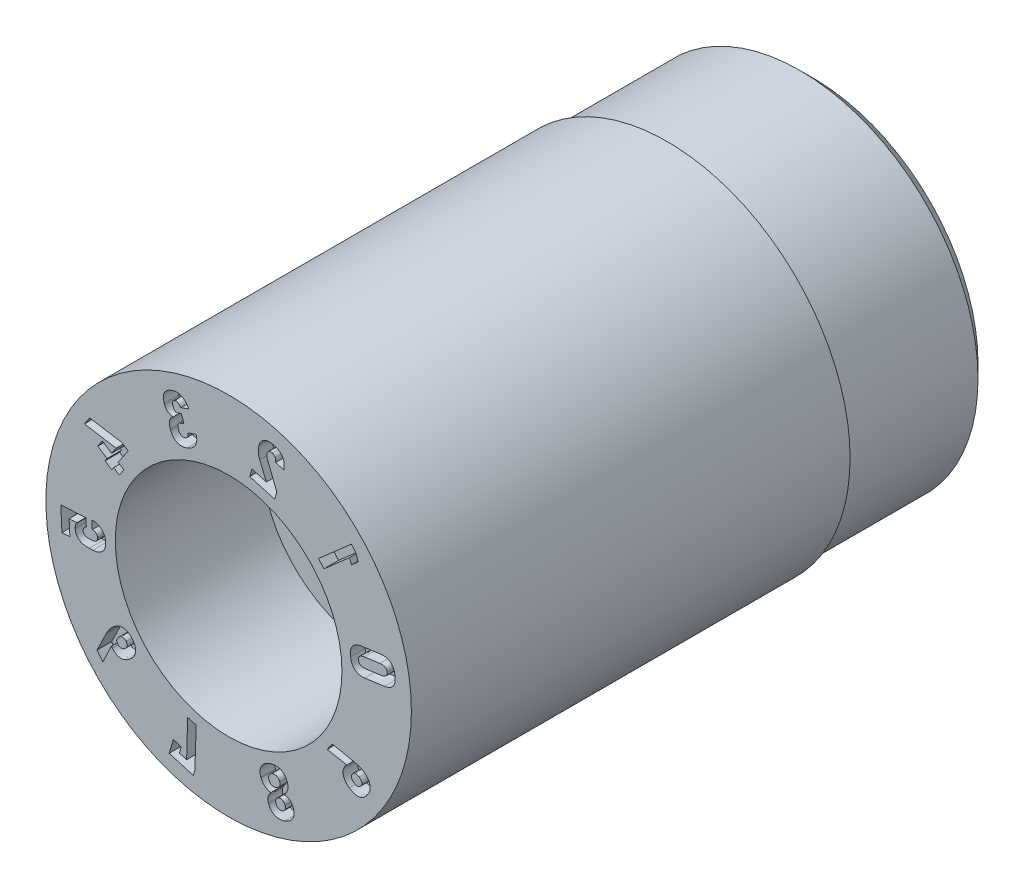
SolidWorks part; units mm, degrees
ref_plane "Front Plane" through (0, 0, 0) normal (0, 0, 1) x (1, 0, 0)
ref_plane "Top Plane" through (0, 0, 0) normal (0, 1, 0) x (1, 0, 0)
ref_plane "Right Plane" through (0, 0, 0) normal (1, 0, 0) x (0, 0, -1)
sketch "Sketch1" plane through (0, 0, 0) normal (1, 0, 0) x (0, 0, -1)
  line L2 (0, 2.5) -> (0, 1.55)
  line L3 (7.75, 2.5) -> (0, 2.5)
  line L4 (-3.7979, 0) -> (49996.2021, 0) construction
  line L8 (8, 0.8) -> (2, 0.8)
  line L9 (2, 1.55) -> (2, 0.8)
  line L10 (2, 1.55) -> (0, 1.55)
  line L12 (8, 0.8) -> (8, 2.25)
  line L16 (8, 2.25) -> (7.75, 2.5)
  dimension "D1" = 8
  dimension "D2" = 45
  dimension "D3" = 0.25
  dimension "D4" = 5
  dimension "D5" = 3.1
  dimension "D6" = 2
  dimension "D7" = 1.6
revolve "Revolve1" add sketch "Sketch1" angle 360 about L4
sketch "Sketch4" plane through (0, 0, 0) normal (1, 0, 0) x (0, 0, -1)
  line L0 (0, 0) -> (50000, 0) construction
  line L1 (8, -2.25) -> (8, 2.25) construction
  line L2 (6, 3.435) -> (8, 3.435)
  line L3 (6, 3.435) -> (6, 2.435)
  line L4 (6, 2.435) -> (8, 2.435)
  line L5 (8, 3.435) -> (8, 2.435)
  line L6 (7.75, 2.5) -> (0, 2.5) construction
  line L7 (0, 2.5) -> (0, -2.5) construction
  dimension "D1" = 1
  dimension "D2" = 0.065
  dimension "D3" = 6
revolve "Cut-Revolve1" cut sketch "Sketch4" angle 360 about L0
sketch "Sketch6" plane through (0, 0, 0) normal (0, 0, 1) x (1, 0, 0)
  line L0 (1.8611, 0.0756) -> (2.1314, 0.113)
  line L1 (2.0824, 0.4687) -> (1.8121, 0.4313)
  line L2 (1.8562, 0.3233) -> (2.0692, 0.3527)
  line L3 (2.0873, 0.221) -> (1.8743, 0.1916)
  line L4 (1.2295, 1.1761) -> (1.3039, 1.0913)
  line L5 (1.3039, 1.0913) -> (1.6538, 1.3984)
  line L6 (1.6538, 1.3984) -> (1.6812, 1.3256)
  line L7 (1.6812, 1.3256) -> (1.771, 1.4045)
  line L8 (1.771, 1.4045) -> (1.7425, 1.4982)
  line L9 (1.7425, 1.4982) -> (1.6789, 1.5706)
  line L10 (1.6789, 1.5706) -> (1.2295, 1.1761)
  line L11 (0.6585, 1.6775) -> (0.5342, 1.9946)
  line L12 (0.5259, 2.0729) -> (0.5261, 2.0738)
  line L13 (0.6427, 2.02) -> (0.6426, 2.0196)
  line L14 (0.6426, 2.0196) -> (0.7543, 1.988)
  line L15 (0.7543, 1.988) -> (0.7544, 1.9884)
  line L16 (0.4149, 2.1088) -> (0.4148, 2.1083)
  line L17 (0.4249, 1.9452) -> (0.5161, 1.7253)
  line L18 (0.5161, 1.7253) -> (0.3185, 1.7812)
  line L19 (0.3185, 1.7812) -> (0.2888, 1.6763)
  line L20 (0.2888, 1.6763) -> (0.6307, 1.5793)
  line L21 (0.6307, 1.5793) -> (0.6585, 1.6775)
  line L22 (-0.4447, 1.8099) -> (-0.555, 1.7704)
  line L23 (-0.6817, 1.736) -> (-0.6865, 1.7493)
  line L24 (-0.6589, 1.8352) -> (-0.6108, 1.8525)
  line L25 (-0.6108, 1.8525) -> (-0.6477, 1.9555)
  line L26 (-0.6477, 1.9555) -> (-0.6958, 1.9382)
  line L27 (-0.7592, 1.9815) -> (-0.7626, 1.9912)
  line L28 (-0.6548, 2.0206) -> (-0.5448, 2.06)
  line L29 (-0.8813, 1.9612) -> (-0.875, 1.944)
  line L30 (-0.7982, 1.7) -> (-0.7921, 1.6827)
  line L31 (-1.462, 1.2061) -> (-1.9012, 1.2762)
  line L32 (-1.9012, 1.2762) -> (-1.9724, 1.1697)
  line L33 (-1.9724, 1.1697) -> (-1.54, 1.098)
  line L34 (-1.54, 1.098) -> (-1.6008, 1.0069)
  line L35 (-1.6898, 0.8734) -> (-1.5989, 0.8128)
  line L36 (-1.5989, 0.8128) -> (-1.5728, 0.852)
  line L37 (-1.3753, 1.1483) -> (-1.462, 1.2061)
  line L38 (-1.7273, 1.0913) -> (-1.7902, 0.997)
  line L39 (-1.7902, 0.997) -> (-1.6636, 0.9126)
  line L40 (-1.4957, 0.8006) -> (-1.4329, 0.8949)
  line L41 (-1.4329, 0.8949) -> (-1.5099, 0.9463)
  line L42 (-1.8701, 0.0844) -> (-1.8705, 0.0845)
  line L43 (-1.8705, 0.0845) -> (-1.865, -0.0286)
  line L44 (-1.865, -0.0286) -> (-1.8646, -0.0287)
  line L45 (-1.8629, -0.1556) -> (-1.9132, -0.1581)
  line L46 (-1.946, -0.0385) -> (-1.9512, 0.0672)
  line L47 (-1.9512, 0.0672) -> (-2.2961, 0.0501)
  line L48 (-2.2961, 0.0501) -> (-2.2802, -0.2722)
  line L49 (-2.2802, -0.2722) -> (-2.1713, -0.2667)
  line L50 (-2.1713, -0.2667) -> (-2.1816, -0.0575)
  line L51 (-2.1816, -0.0575) -> (-2.0756, -0.0523)
  line L52 (-1.9076, -0.2711) -> (-1.8573, -0.2686)
  line L53 (-1.5689, -1.0288) -> (-1.5693, -1.0291)
  line L54 (-1.6739, -1.166) -> (-1.8006, -1.4237)
  line L55 (-1.8006, -1.4237) -> (-1.7205, -1.5243)
  line L56 (-1.7205, -1.5243) -> (-1.6018, -1.2772)
  line L58 (-1.3507, -1.3063) -> (-1.3505, -1.3061)
  line L59 (-1.4157, -1.2127) -> (-1.4162, -1.213)
  line L60 (-1.4941, -1.1144) -> (-1.494, -1.1142)
  line L61 (-0.462, -2.1775) -> (-0.4428, -1.6341)
  line L62 (-0.4428, -1.6341) -> (-0.5608, -1.5995)
  line L63 (-0.5608, -1.5995) -> (-0.5742, -2.1091)
  line L64 (-0.5742, -2.1091) -> (-0.6736, -2.0799)
  line L65 (-0.6736, -2.0799) -> (-0.648, -1.9929)
  line L66 (-0.648, -1.9929) -> (-0.7568, -1.9609)
  line L67 (-0.7568, -1.9609) -> (-0.8132, -2.1528)
  line L68 (-0.8132, -2.1528) -> (-0.4832, -2.2499)
  line L69 (-0.4832, -2.2499) -> (-0.462, -2.1775)
  line L70 (0.4402, -1.8068) -> (0.4435, -1.8161)
  line L71 (0.5433, -2.0598) -> (0.5486, -2.0746)
  line L72 (0.8844, -1.9551) -> (0.8791, -1.9403)
  line L73 (0.8026, -1.6884) -> (0.7993, -1.6791)
  line L74 (0.698, -1.7325) -> (0.7, -1.738)
  line L75 (0.5542, -1.7895) -> (0.5521, -1.7836)
  line L76 (0.7707, -1.974) -> (0.7726, -1.9794)
  line L77 (0.6503, -2.0226) -> (0.6482, -2.0167)
  line L79 (1.6509, -1.3297) -> (1.6513, -1.33)
  line L80 (1.846, -1.0392) -> (1.8457, -1.039)
  line L81 (1.6878, -0.9826) -> (1.4157, -0.9273)
  line L82 (1.4157, -0.9273) -> (1.3488, -1.026)
  line L83 (1.3488, -1.026) -> (1.6181, -1.076)
  line L84 (1.7868, -1.1353) -> (1.7872, -1.1355)
  line L85 (1.7168, -1.2383) -> (1.7166, -1.2381)
  line L86 (-1.6008, 1.0069) -> (-1.7273, 1.0913)
  line L87 (-1.6636, 0.9126) -> (-1.6898, 0.8734)
  line L88 (-1.5099, 0.9463) -> (-1.3753, 1.1483)
  line L89 (-1.5728, 0.852) -> (-1.4957, 0.8006)
  spline S0 degree 3 poles (1.6678, 0.2302) (1.6698, 0.2165) (1.6734, 0.1966) (1.6819, 0.1718) (1.689, 0.1551) (1.6977, 0.14) (1.7073, 0.1263) (1.7183, 0.1142) (1.7305, 0.1036) (1.7438, 0.0946) (1.7579, 0.0871) (1.773, 0.0811) (1.789, 0.0769) (1.8058, 0.0741) (1.83, 0.0726) (1.8486, 0.0739) (1.8611, 0.0756) knots 0 0 0 0 0.147056 0.214375 0.278722 0.339947 0.398942 0.456553 0.513576 0.570222 0.626668 0.683923 0.742465 0.802418 0.864973 1 1 1 1
  spline S1 degree 3 poles (2.1314, 0.113) (2.144, 0.1149) (2.1625, 0.1184) (2.1854, 0.1267) (2.201, 0.1337) (2.2152, 0.1424) (2.2281, 0.1521) (2.2397, 0.1632) (2.2499, 0.1755) (2.2587, 0.1891) (2.266, 0.2037) (2.2716, 0.2195) (2.2756, 0.2363) (2.278, 0.2542) (2.2791, 0.2803) (2.2778, 0.3004) (2.2758, 0.314) knots 0 0 0 0 0.136085 0.199106 0.25927 0.31776 0.37501 0.431454 0.487864 0.54501 0.602411 0.661485 0.722637 0.786519 0.853705 1 1 1 1
  spline S2 degree 3 poles (2.2758, 0.314) (2.2738, 0.3277) (2.27, 0.3475) (2.2618, 0.3724) (2.2546, 0.389) (2.2462, 0.4042) (2.2364, 0.4179) (2.2256, 0.4301) (2.2135, 0.4407) (2.2004, 0.4497) (2.1864, 0.4574) (2.1712, 0.463) (2.1553, 0.4676) (2.1384, 0.4702) (2.1139, 0.4717) (2.0951, 0.4705) (2.0824, 0.4687) knots 0 0 0 0 0.146845 0.214047 0.277872 0.339327 0.398238 0.455574 0.51228 0.568566 0.624619 0.681531 0.739841 0.800493 0.863366 1 1 1 1
  spline S3 degree 3 poles (1.8121, 0.4313) (1.7995, 0.4294) (1.781, 0.4259) (1.7581, 0.4176) (1.7425, 0.4106) (1.7284, 0.4019) (1.7154, 0.3922) (1.7038, 0.3811) (1.6936, 0.3688) (1.6848, 0.3553) (1.6777, 0.3405) (1.6721, 0.3248) (1.668, 0.3079) (1.6657, 0.2899) (1.6642, 0.2639) (1.6661, 0.2438) (1.6678, 0.2302) knots 0 0 0 0 0.136066 0.199078 0.259234 0.317715 0.374957 0.431394 0.487795 0.544934 0.602359 0.661425 0.722568 0.786441 0.853757 1 1 1 1
  spline S4 degree 3 poles (1.7758, 0.245) (1.7743, 0.255) (1.7746, 0.2702) (1.7825, 0.2881) (1.7917, 0.2989) (1.804, 0.3075) (1.8251, 0.3178) (1.8434, 0.3214) (1.8562, 0.3233) knots 0 0 0 0 0.239113 0.345041 0.452478 0.56778 0.69516 1 1 1 1
  spline S5 degree 3 poles (2.0692, 0.3527) (2.082, 0.3545) (2.1006, 0.3556) (2.1236, 0.3517) (2.1356, 0.3474) (2.1438, 0.3426) (2.1492, 0.3384) (2.154, 0.3335) (2.1582, 0.3279) (2.1616, 0.3216) (2.1653, 0.3121) (2.167, 0.3045) (2.1678, 0.2992) knots 0 0 0 0 0.304028 0.431522 0.54651 0.600639 0.654019 0.707536 0.76083 0.816755 0.874436 1 1 1 1
  spline S6 degree 3 poles (2.1678, 0.2992) (2.1686, 0.2939) (2.1689, 0.2861) (2.1679, 0.2759) (2.1663, 0.269) (2.1638, 0.2625) (2.1604, 0.2566) (2.1564, 0.2511) (2.1498, 0.2442) (2.1394, 0.2367) (2.1183, 0.2265) (2.1001, 0.2228) (2.0873, 0.221) knots 0 0 0 0 0.125998 0.182684 0.23836 0.292332 0.345112 0.398324 0.452811 0.568511 0.695957 1 1 1 1
  spline S7 degree 3 poles (1.8743, 0.1916) (1.8615, 0.1898) (1.8429, 0.1886) (1.8198, 0.1926) (1.8079, 0.197) (1.7997, 0.2018) (1.7943, 0.206) (1.7895, 0.2109) (1.7854, 0.2164) (1.7821, 0.2226) (1.7781, 0.232) (1.7766, 0.2397) (1.7758, 0.245) knots 0 0 0 0 0.3054 0.432224 0.547954 0.602164 0.655624 0.707922 0.761297 0.816372 0.874243 1 1 1 1
  spline S8 degree 3 poles (0.5342, 1.9946) (0.5288, 2.0079) (0.5242, 2.0254) (0.5228, 2.0462) (0.523, 2.0585) (0.5244, 2.0673) (0.5259, 2.0729) knots 0 0 0 0 0.540332 0.666219 0.783312 1 1 1 1
  spline S9 degree 3 poles (0.5261, 2.0738) (0.5282, 2.0808) (0.5325, 2.0908) (0.5426, 2.1008) (0.5514, 2.106) (0.5615, 2.1092) (0.5774, 2.1108) (0.5897, 2.1084) (0.598, 2.1061) knots 0 0 0 0 0.245514 0.356498 0.46891 0.585213 0.709803 1 1 1 1
  spline S10 degree 3 poles (0.598, 2.1061) (0.6063, 2.1037) (0.6182, 2.0984) (0.6303, 2.0864) (0.6372, 2.076) (0.642, 2.064) (0.6455, 2.0451) (0.6443, 2.0302) (0.6427, 2.02) knots 0 0 0 0 0.240931 0.353957 0.46888 0.587518 0.712959 1 1 1 1
  spline S11 degree 3 poles (0.7544, 1.9884) (0.7582, 2.0057) (0.7612, 2.0315) (0.7598, 2.0653) (0.7553, 2.0886) (0.7485, 2.1105) (0.7388, 2.1308) (0.7264, 2.1492) (0.7115, 2.1658) (0.6941, 2.1805) (0.6671, 2.1974) (0.6444, 2.2063) (0.6286, 2.2108) knots 0 0 0 0 0.185461 0.271332 0.35408 0.434239 0.512036 0.589074 0.66671 0.745914 0.827271 1 1 1 1
  spline S12 degree 3 poles (0.6286, 2.2108) (0.6118, 2.2154) (0.5869, 2.2208) (0.554, 2.2217) (0.5315, 2.2199) (0.5105, 2.2152) (0.4911, 2.2078) (0.4735, 2.1976) (0.4577, 2.1847) (0.4437, 2.1694) (0.4275, 2.1448) (0.4192, 2.1236) (0.4149, 2.1088) knots 0 0 0 0 0.195014 0.282868 0.366388 0.446163 0.522132 0.597031 0.672126 0.748498 0.827698 1 1 1 1
  spline S13 degree 3 poles (0.4148, 2.1083) (0.4111, 2.0952) (0.4074, 2.0749) (0.4056, 2.0474) (0.4062, 2.0263) (0.4084, 2.0053) (0.4132, 1.9779) (0.4196, 1.958) (0.4249, 1.9452) knots 0 0 0 0 0.245991 0.370325 0.497769 0.625118 0.750586 1 1 1 1
  spline S14 degree 3 poles (-0.5696, 1.586) (-0.5533, 1.5919) (-0.5299, 1.6025) (-0.5024, 1.6215) (-0.4843, 1.637) (-0.4689, 1.6543) (-0.4563, 1.6732) (-0.4465, 1.6934) (-0.4396, 1.7151) (-0.4357, 1.7378) (-0.4353, 1.7699) (-0.4397, 1.794) (-0.4447, 1.8099) knots 0 0 0 0 0.181603 0.266805 0.349592 0.429898 0.508309 0.586193 0.664883 0.745025 0.826415 1 1 1 1
  spline S15 degree 3 poles (-0.555, 1.7704) (-0.5536, 1.7646) (-0.5529, 1.756) (-0.553, 1.7447) (-0.5545, 1.7369) (-0.5566, 1.7295) (-0.5597, 1.7226) (-0.5637, 1.7163) (-0.5683, 1.7106) (-0.5738, 1.7054) (-0.5826, 1.6994) (-0.5898, 1.6958) (-0.5951, 1.694) knots 0 0 0 0 0.186573 0.271921 0.354621 0.434944 0.513458 0.590452 0.667605 0.745941 0.826925 1 1 1 1
  spline S16 degree 3 poles (-0.5951, 1.694) (-0.6042, 1.6908) (-0.6181, 1.6876) (-0.6363, 1.6895) (-0.6483, 1.6936) (-0.6591, 1.7005) (-0.6719, 1.7139) (-0.6785, 1.7267) (-0.6817, 1.736) knots 0 0 0 0 0.265795 0.382656 0.496403 0.611512 0.730293 1 1 1 1
  spline S17 degree 3 poles (-0.6865, 1.7493) (-0.6897, 1.759) (-0.6939, 1.7732) (-0.6937, 1.7919) (-0.6915, 1.8039) (-0.6868, 1.8145) (-0.677, 1.8268) (-0.6663, 1.8325) (-0.6589, 1.8352) knots 0 0 0 0 0.299685 0.427918 0.545279 0.65605 0.764944 1 1 1 1
  spline S18 degree 3 poles (-0.6958, 1.9382) (-0.7019, 1.9359) (-0.7117, 1.9345) (-0.7243, 1.9375) (-0.7329, 1.9423) (-0.7409, 1.9491) (-0.7508, 1.9617) (-0.7563, 1.9731) (-0.7592, 1.9815) knots 0 0 0 0 0.227215 0.333285 0.444905 0.564191 0.694312 1 1 1 1
  spline S19 degree 3 poles (-0.7626, 1.9912) (-0.7652, 1.999) (-0.7685, 2.0107) (-0.7677, 2.0261) (-0.7651, 2.0361) (-0.7605, 2.0449) (-0.7514, 2.0552) (-0.742, 2.0603) (-0.7353, 2.0627) knots 0 0 0 0 0.287471 0.412139 0.528295 0.640068 0.752903 1 1 1 1
  spline S20 degree 3 poles (-0.7353, 2.0627) (-0.7307, 2.0643) (-0.7235, 2.0661) (-0.7136, 2.0658) (-0.7063, 2.0649) (-0.6991, 2.0626) (-0.6919, 2.0596) (-0.685, 2.0554) (-0.6783, 2.0504) (-0.672, 2.0443) (-0.6634, 2.0348) (-0.6582, 2.0264) (-0.6548, 2.0206) knots 0 0 0 0 0.148696 0.221311 0.296365 0.371934 0.449683 0.529631 0.614556 0.702792 0.796564 1 1 1 1
  spline S21 degree 3 poles (-0.5448, 2.06) (-0.5522, 2.0758) (-0.565, 2.0981) (-0.5867, 2.1237) (-0.6042, 2.1398) (-0.6231, 2.153) (-0.643, 2.1636) (-0.6641, 2.171) (-0.6859, 2.1757) (-0.7083, 2.1774) (-0.7389, 2.1758) (-0.7616, 2.1702) (-0.7763, 2.1649) knots 0 0 0 0 0.185877 0.272167 0.356231 0.437646 0.517123 0.595494 0.674175 0.753594 0.833545 1 1 1 1
  spline S22 degree 3 poles (-0.7763, 2.1649) (-0.7883, 2.1607) (-0.8053, 2.1534) (-0.826, 2.1414) (-0.8397, 2.1317) (-0.8518, 2.1213) (-0.8626, 2.1101) (-0.8717, 2.0979) (-0.8793, 2.085) (-0.8853, 2.0714) (-0.8898, 2.0573) (-0.8926, 2.0425) (-0.8937, 2.0273) (-0.893, 2.0114) (-0.8899, 1.989) (-0.8852, 1.9723) (-0.8813, 1.9612) knots 0 0 0 0 0.145412 0.212404 0.275883 0.337328 0.396364 0.454255 0.511666 0.568287 0.624864 0.682142 0.740516 0.800728 0.864104 1 1 1 1
  spline S23 degree 3 poles (-0.875, 1.944) (-0.8706, 1.9316) (-0.8618, 1.9139) (-0.845, 1.8944) (-0.8308, 1.8821) (-0.8148, 1.8722) (-0.791, 1.8625) (-0.7716, 1.8594) (-0.7584, 1.859) knots 0 0 0 0 0.257293 0.378795 0.50045 0.621221 0.7427 1 1 1 1
  spline S24 degree 3 poles (-0.7584, 1.859) (-0.7645, 1.8552) (-0.7728, 1.8486) (-0.7829, 1.8388) (-0.7892, 1.8307) (-0.7949, 1.8223) (-0.7996, 1.8132) (-0.8035, 1.8036) (-0.8065, 1.7934) (-0.8088, 1.7829) (-0.8099, 1.772) (-0.8104, 1.7607) (-0.8096, 1.7492) (-0.8084, 1.7373) (-0.805, 1.7207) (-0.8013, 1.7083) (-0.7982, 1.7) knots 0 0 0 0 0.120732 0.178523 0.235878 0.292426 0.349801 0.407413 0.466679 0.527112 0.58814 0.651217 0.715872 0.782743 0.851998 1 1 1 1
  spline S25 degree 3 poles (-0.7921, 1.6827) (-0.7866, 1.6673) (-0.7764, 1.6456) (-0.7581, 1.6204) (-0.7428, 1.605) (-0.726, 1.5922) (-0.7074, 1.5824) (-0.6874, 1.5755) (-0.666, 1.5715) (-0.6433, 1.5707) (-0.6105, 1.5733) (-0.5859, 1.5802) (-0.5696, 1.586) knots 0 0 0 0 0.177849 0.259119 0.337485 0.413634 0.488574 0.564396 0.643088 0.724731 0.810719 1 1 1 1
  spline S26 degree 3 poles (-1.6819, -0.0825) (-1.6828, -0.0671) (-1.6861, -0.0443) (-1.6968, -0.016) (-1.7071, 0.0036) (-1.7198, 0.0214) (-1.735, 0.0373) (-1.7527, 0.051) (-1.7725, 0.0628) (-1.7943, 0.0722) (-1.8268, 0.0814) (-1.8525, 0.0841) (-1.8701, 0.0844) knots 0 0 0 0 0.165188 0.244703 0.323004 0.401021 0.478736 0.557771 0.639574 0.724366 0.811743 1 1 1 1
  spline S27 degree 3 poles (-1.8646, -0.0287) (-1.8546, -0.0294) (-1.84, -0.0313) (-1.8227, -0.0387) (-1.8121, -0.0459) (-1.8035, -0.0547) (-1.7947, -0.0688) (-1.792, -0.0812) (-1.7916, -0.0896) knots 0 0 0 0 0.286812 0.41288 0.532177 0.647647 0.760112 1 1 1 1
  spline S28 degree 3 poles (-1.7916, -0.0896) (-1.7911, -0.0985) (-1.7924, -0.112) (-1.8004, -0.1274) (-1.8086, -0.137) (-1.8191, -0.1447) (-1.837, -0.1529) (-1.8523, -0.155) (-1.8629, -0.1556) knots 0 0 0 0 0.245303 0.356179 0.468475 0.585011 0.709669 1 1 1 1
  spline S29 degree 3 poles (-1.9132, -0.1581) (-1.9237, -0.1584) (-1.939, -0.1581) (-1.9576, -0.1525) (-1.9687, -0.1465) (-1.9777, -0.1388) (-1.9868, -0.1258) (-1.9894, -0.1139) (-1.9898, -0.1059) knots 0 0 0 0 0.303706 0.432973 0.55152 0.66222 0.769409 1 1 1 1
  spline S30 degree 3 poles (-1.9898, -0.1059) (-1.9903, -0.0983) (-1.9893, -0.0871) (-1.9847, -0.0731) (-1.9797, -0.0638) (-1.9733, -0.0554) (-1.9626, -0.0459) (-1.953, -0.0408) (-1.946, -0.0385) knots 0 0 0 0 0.263247 0.384983 0.506898 0.627479 0.746394 1 1 1 1
  spline S31 degree 3 poles (-2.0756, -0.0523) (-2.0799, -0.0569) (-2.0847, -0.0654) (-2.0904, -0.0775) (-2.0968, -0.0987) (-2.0993, -0.1174) (-2.0985, -0.1324) knots 0 0 0 0 0.220539 0.341672 0.473117 1 1 1 1
  spline S32 degree 3 poles (-2.0985, -0.1324) (-2.0979, -0.147) (-2.0943, -0.1683) (-2.0839, -0.1944) (-2.0735, -0.2115) (-2.0606, -0.2265) (-2.0454, -0.2398) (-2.0276, -0.2504) (-2.0077, -0.2593) (-1.9855, -0.2657) (-1.952, -0.2715) (-1.9256, -0.2719) (-1.9076, -0.2711) knots 0 0 0 0 0.164054 0.23986 0.313888 0.387451 0.461834 0.538554 0.619423 0.705769 0.796958 1 1 1 1
  spline S33 degree 3 poles (-1.8573, -0.2686) (-1.8392, -0.2675) (-1.8129, -0.2643) (-1.7803, -0.2536) (-1.7589, -0.2434) (-1.7399, -0.2308) (-1.7233, -0.216) (-1.7094, -0.1987) (-1.6983, -0.1793) (-1.6898, -0.1578) (-1.682, -0.1256) (-1.6811, -0.0999) (-1.6819, -0.0825) knots 0 0 0 0 0.187269 0.27221 0.353281 0.43103 0.506861 0.581847 0.658451 0.737122 0.819636 1 1 1 1
  spline S34 degree 3 poles (-1.3165, -1.0531) (-1.3273, -1.0395) (-1.3448, -1.0211) (-1.3718, -1.0021) (-1.3922, -0.9916) (-1.4133, -0.9842) (-1.4349, -0.9805) (-1.457, -0.9799) (-1.4794, -0.9831) (-1.502, -0.9894) (-1.5331, -1.003) (-1.5549, -1.0176) (-1.5689, -1.0288) knots 0 0 0 0 0.180538 0.262925 0.342137 0.418908 0.49408 0.569861 0.647851 0.728518 0.813183 1 1 1 1
  spline S35 degree 3 poles (-1.5693, -1.0291) (-1.578, -1.0362) (-1.591, -1.0476) (-1.6067, -1.0648) (-1.6315, -1.0933) (-1.6487, -1.1202) (-1.6615, -1.1424) knots 0 0 0 0 0.229993 0.351155 0.476209 1 1 1 1
  spline S36 degree 3 poles (-1.6615, -1.1424) (-1.6638, -1.1463) (-1.6682, -1.154) (-1.6721, -1.162) (-1.6739, -1.166) knots 0 0 0 0 0.506239 1 1 1 1
  spline S37 degree 3 poles (-1.6018, -1.2772) (-1.5984, -1.2837) (-1.5942, -1.2898) (-1.5897, -1.2956) knots 0.758865 0.758865 0.758865 0.758865 1 1 1 1
  spline S38 degree 3 poles (-1.5897, -1.2956) (-1.58, -1.3078) (-1.5641, -1.3243) (-1.5393, -1.3406) (-1.5204, -1.3496) (-1.5006, -1.3552) (-1.4802, -1.3578) (-1.4593, -1.3569) (-1.4378, -1.3531) (-1.416, -1.346) (-1.3859, -1.3318) (-1.3644, -1.3174) (-1.3507, -1.3063) knots 0 0 0 0 0.171751 0.250485 0.326916 0.40172 0.476806 0.552775 0.632421 0.71615 0.804985 1 1 1 1
  spline S39 degree 3 poles (-1.3505, -1.3061) (-1.3365, -1.2947) (-1.3169, -1.2768) (-1.2967, -1.2491) (-1.2852, -1.2283) (-1.2769, -1.207) (-1.2724, -1.1852) (-1.271, -1.1631) (-1.2734, -1.1409) (-1.2789, -1.1185) (-1.2917, -1.088) (-1.3054, -1.0666) (-1.3165, -1.0531) knots 0 0 0 0 0.187232 0.271998 0.353496 0.431801 0.507661 0.582895 0.659383 0.738345 0.820299 1 1 1 1
  spline S40 degree 3 poles (-1.4022, -1.1214) (-1.3966, -1.1285) (-1.3894, -1.1399) (-1.3862, -1.1568) (-1.3865, -1.1689) (-1.3898, -1.1808) (-1.3982, -1.1967) (-1.4082, -1.2067) (-1.4157, -1.2127) knots 0 0 0 0 0.25922 0.373992 0.488034 0.603496 0.723903 1 1 1 1
  spline S41 degree 3 poles (-1.4162, -1.213) (-1.4249, -1.2198) (-1.4382, -1.2289) (-1.4577, -1.2351) (-1.4712, -1.2366) (-1.484, -1.235) (-1.5003, -1.2285) (-1.5105, -1.2195) (-1.5161, -1.2123) knots 0 0 0 0 0.294397 0.420615 0.538 0.649666 0.758779 1 1 1 1
  spline S42 degree 3 poles (-1.5161, -1.2123) (-1.522, -1.2053) (-1.5283, -1.1933) (-1.531, -1.1758) (-1.5295, -1.1628) (-1.5249, -1.15) (-1.5145, -1.1324) (-1.5028, -1.1213) (-1.4941, -1.1144) knots 0 0 0 0 0.240459 0.350227 0.462943 0.581009 0.707347 1 1 1 1
  spline S43 degree 3 poles (-1.494, -1.1142) (-1.4864, -1.1082) (-1.4745, -1.1007) (-1.4571, -1.096) (-1.4448, -1.0956) (-1.4329, -1.0979) (-1.4172, -1.1049) (-1.4078, -1.1145) (-1.4022, -1.1214) knots 0 0 0 0 0.276884 0.398103 0.512857 0.626224 0.741689 1 1 1 1
  spline S44 degree 3 poles (0.5636, -1.5855) (0.5467, -1.5915) (0.5226, -1.6024) (0.4942, -1.6219) (0.476, -1.638) (0.4607, -1.6557) (0.448, -1.6745) (0.4387, -1.6948) (0.4324, -1.716) (0.4292, -1.7381) (0.4296, -1.7689) (0.4349, -1.7919) (0.4402, -1.8068) knots 0 0 0 0 0.188987 0.276722 0.361704 0.443542 0.522602 0.599494 0.676914 0.754587 0.8336 1 1 1 1
  spline S45 degree 3 poles (0.4435, -1.8161) (0.4484, -1.83) (0.4588, -1.85) (0.4781, -1.8729) (0.4951, -1.8881) (0.5137, -1.9012) (0.5407, -1.9148) (0.5627, -1.9203) (0.5777, -1.922) knots 0 0 0 0 0.246171 0.370574 0.497855 0.625206 0.749638 1 1 1 1
  spline S46 degree 3 poles (0.5777, -1.922) (0.5687, -1.9311) (0.5569, -1.9465) (0.546, -1.9696) (0.5401, -1.9877) (0.5368, -2.0062) (0.5358, -2.0306) (0.5392, -2.0486) (0.5433, -2.0598) knots 0 0 0 0 0.257362 0.384265 0.511949 0.638327 0.76001 1 1 1 1
  spline S47 degree 3 poles (0.5486, -2.0746) (0.5536, -2.0886) (0.5632, -2.1087) (0.5814, -2.1313) (0.5968, -2.1456) (0.614, -2.1575) (0.6328, -2.1668) (0.6532, -2.1731) (0.6748, -2.177) (0.6975, -2.178) (0.7296, -2.1756) (0.7535, -2.1691) (0.7694, -2.1635) knots 0 0 0 0 0.166823 0.245804 0.324183 0.401756 0.479173 0.558312 0.640213 0.724606 0.811861 1 1 1 1
  spline S48 degree 3 poles (0.7694, -2.1635) (0.7852, -2.1579) (0.8077, -2.1476) (0.8343, -2.1294) (0.8512, -2.1142) (0.8657, -2.0977) (0.8771, -2.0797) (0.8861, -2.0608) (0.8918, -2.0407) (0.8947, -2.0198) (0.8943, -1.9908) (0.8894, -1.9691) (0.8844, -1.9551) knots 0 0 0 0 0.187886 0.275794 0.360339 0.441912 0.520725 0.597892 0.675637 0.753789 0.83306 1 1 1 1
  spline S49 degree 3 poles (0.8791, -1.9403) (0.8751, -1.9288) (0.8662, -1.9126) (0.8499, -1.8941) (0.8354, -1.882) (0.8193, -1.8717) (0.7959, -1.8611) (0.7771, -1.8567) (0.7643, -1.8556) knots 0 0 0 0 0.242256 0.364286 0.490072 0.617829 0.743975 1 1 1 1
  spline S50 degree 3 poles (0.7643, -1.8556) (0.775, -1.8448) (0.7884, -1.8262) (0.8012, -1.7987) (0.8077, -1.7767) (0.8114, -1.7542) (0.812, -1.7243) (0.8075, -1.7023) (0.8026, -1.6884) knots 0 0 0 0 0.251904 0.376442 0.50423 0.631392 0.754492 1 1 1 1
  spline S51 degree 3 poles (0.7993, -1.6791) (0.794, -1.6641) (0.7835, -1.6431) (0.7645, -1.6188) (0.748, -1.6037) (0.7297, -1.5913) (0.7096, -1.5815) (0.688, -1.5747) (0.6649, -1.5709) (0.6406, -1.57) (0.6062, -1.5726) (0.5806, -1.5797) (0.5636, -1.5855) knots 0 0 0 0 0.16662 0.245042 0.322975 0.400383 0.47745 0.556367 0.638037 0.723053 0.811133 1 1 1 1
  spline S52 degree 3 poles (0.6003, -1.6884) (0.6071, -1.6862) (0.6174, -1.6832) (0.6314, -1.6827) (0.6413, -1.6834) (0.6509, -1.6855) (0.6599, -1.6887) (0.6683, -1.6934) (0.6761, -1.6991) (0.6831, -1.7059) (0.6911, -1.7168) (0.6958, -1.7259) (0.698, -1.7325) knots 0 0 0 0 0.179064 0.263912 0.346471 0.427308 0.506505 0.584343 0.665085 0.745783 0.828048 1 1 1 1
  spline S53 degree 3 poles (0.7, -1.738) (0.7023, -1.744) (0.7041, -1.7533) (0.7044, -1.7658) (0.703, -1.7748) (0.7004, -1.7835) (0.6965, -1.7916) (0.6916, -1.7993) (0.6854, -1.8065) (0.6781, -1.8131) (0.6665, -1.8208) (0.6568, -1.8255) (0.6499, -1.8278) knots 0 0 0 0 0.166478 0.244771 0.323386 0.40112 0.478696 0.556624 0.638357 0.723073 0.811168 1 1 1 1
  spline S54 degree 3 poles (0.6499, -1.8278) (0.6431, -1.8303) (0.6327, -1.8329) (0.6188, -1.834) (0.609, -1.8336) (0.5996, -1.832) (0.5909, -1.8291) (0.5827, -1.8252) (0.5752, -1.82) (0.5685, -1.8138) (0.5606, -1.8041) (0.5563, -1.7955) (0.5542, -1.7895) knots 0 0 0 0 0.188192 0.275451 0.35996 0.442284 0.520171 0.5981 0.676258 0.755232 0.834403 1 1 1 1
  spline S55 degree 3 poles (0.5521, -1.7836) (0.5498, -1.7771) (0.5474, -1.7671) (0.547, -1.7536) (0.5481, -1.7439) (0.5506, -1.7347) (0.5541, -1.7259) (0.5591, -1.7178) (0.5653, -1.7102) (0.5725, -1.7034) (0.5839, -1.6953) (0.5935, -1.6907) (0.6003, -1.6884) knots 0 0 0 0 0.172936 0.255037 0.335718 0.415174 0.493134 0.572066 0.653169 0.735901 0.820596 1 1 1 1
  spline S56 degree 3 poles (0.6867, -1.9315) (0.6925, -1.9296) (0.7013, -1.9272) (0.7132, -1.9269) (0.7217, -1.9278) (0.7298, -1.9298) (0.7374, -1.9332) (0.7447, -1.9373) (0.7513, -1.9429) (0.7573, -1.9493) (0.7646, -1.9593) (0.7685, -1.968) (0.7707, -1.974) knots 0 0 0 0 0.173533 0.254939 0.334837 0.413932 0.490776 0.569585 0.650762 0.732826 0.818272 1 1 1 1
  spline S57 degree 3 poles (0.7726, -1.9794) (0.7746, -1.985) (0.7768, -1.9937) (0.7771, -2.0053) (0.7764, -2.0135) (0.7745, -2.0214) (0.7715, -2.0288) (0.7674, -2.0357) (0.7624, -2.0422) (0.7563, -2.0478) (0.7469, -2.055) (0.7385, -2.0586) (0.7328, -2.0607) knots 0 0 0 0 0.176162 0.259112 0.339636 0.419227 0.49595 0.574093 0.654053 0.735781 0.819764 1 1 1 1
  spline S58 degree 3 poles (0.7328, -2.0607) (0.727, -2.0628) (0.7182, -2.0651) (0.7065, -2.0656) (0.6981, -2.0651) (0.69, -2.0633) (0.6824, -2.0605) (0.6754, -2.0565) (0.669, -2.0515) (0.6631, -2.0457) (0.6562, -2.0363) (0.6523, -2.0282) (0.6503, -2.0226) knots 0 0 0 0 0.180118 0.262908 0.344764 0.425429 0.502965 0.581158 0.659569 0.741112 0.823497 1 1 1 1
  spline S59 degree 3 poles (0.6482, -2.0167) (0.6463, -2.0107) (0.6437, -2.0017) (0.6433, -1.9895) (0.6439, -1.9809) (0.6456, -1.9725) (0.6484, -1.9647) (0.6523, -1.9575) (0.6573, -1.9507) (0.6632, -1.9446) (0.6727, -1.9374) (0.6809, -1.9335) (0.6867, -1.9315) knots 0 0 0 0 0.179592 0.263525 0.346584 0.427559 0.504714 0.582869 0.662097 0.742847 0.824254 1 1 1 1
  spline S60 degree 3 poles (1.6181, -1.076) (1.6176, -1.0763) (1.614, -1.0792) (1.604, -1.0883) (1.5962, -1.0987) (1.5911, -1.1059) knots 0.563739 0.563739 0.563739 0.563739 0.582119 0.713215 1 1 1 1
  spline S61 degree 3 poles (1.5911, -1.1059) (1.5832, -1.1178) (1.573, -1.1366) (1.5662, -1.1637) (1.5639, -1.1839) (1.5649, -1.2042) (1.5687, -1.2242) (1.5755, -1.2438) (1.5853, -1.2629) (1.5978, -1.2813) (1.6183, -1.3053) (1.6374, -1.3203) (1.6509, -1.3297) knots 0 0 0 0 0.165012 0.243337 0.320835 0.398344 0.475786 0.554754 0.636795 0.722351 0.810252 1 1 1 1
  spline S62 degree 3 poles (1.6513, -1.33) (1.6662, -1.34) (1.6891, -1.3532) (1.7214, -1.3641) (1.7445, -1.369) (1.767, -1.3704) (1.7889, -1.3686) (1.8101, -1.3632) (1.8305, -1.3545) (1.85, -1.3426) (1.8753, -1.3216) (1.8914, -1.3021) (1.9011, -1.2878) knots 0 0 0 0 0.187846 0.273111 0.354386 0.432279 0.507654 0.582614 0.659076 0.737901 0.819963 1 1 1 1
  spline S63 degree 3 poles (1.9011, -1.2878) (1.9106, -1.2735) (1.923, -1.2514) (1.9327, -1.2201) (1.9366, -1.1975) (1.9369, -1.1753) (1.9339, -1.1535) (1.9272, -1.1324) (1.9175, -1.1117) (1.9042, -1.092) (1.8818, -1.066) (1.8609, -1.0495) (1.846, -1.0392) knots 0 0 0 0 0.178213 0.26031 0.338857 0.415273 0.49015 0.566081 0.644482 0.726181 0.811643 1 1 1 1
  spline S64 degree 3 poles (1.8457, -1.039) (1.8371, -1.0331) (1.8231, -1.0252) (1.8033, -1.0159) (1.787, -1.0095) (1.7696, -1.0035) (1.7444, -0.996) (1.7249, -0.9908) (1.7115, -0.9878) knots 0 0 0 0 0.216673 0.332921 0.453959 0.581294 0.714502 1 1 1 1
  spline S65 degree 3 poles (1.7115, -0.9878) (1.7075, -0.9868) (1.6997, -0.9846) (1.6917, -0.9833) (1.6878, -0.9826) knots 0 0 0 0 0.50772 1 1 1 1
  spline S66 degree 3 poles (1.6914, -1.1455) (1.6964, -1.1381) (1.7055, -1.1284) (1.7208, -1.1205) (1.7331, -1.1179) (1.746, -1.1179) (1.7649, -1.1222) (1.7783, -1.1293) (1.7868, -1.1353) knots 0 0 0 0 0.245706 0.358532 0.471223 0.588703 0.71181 1 1 1 1
  spline S67 degree 3 poles (1.7872, -1.1355) (1.7955, -1.1412) (1.8067, -1.1506) (1.817, -1.1661) (1.8216, -1.1778) (1.8233, -1.19) (1.8213, -1.207) (1.8157, -1.219) (1.8106, -1.2263) knots 0 0 0 0 0.28426 0.406094 0.522079 0.63571 0.748718 1 1 1 1
  spline S68 degree 3 poles (1.8106, -1.2263) (1.8055, -1.2337) (1.7966, -1.2438) (1.7813, -1.2518) (1.7693, -1.2546) (1.7566, -1.2548) (1.7382, -1.2508) (1.7252, -1.2441) (1.7168, -1.2383) knots 0 0 0 0 0.252427 0.365776 0.478544 0.594271 0.716859 1 1 1 1
  spline S69 degree 3 poles (1.7166, -1.2381) (1.708, -1.2323) (1.6963, -1.2226) (1.6855, -1.2066) (1.6807, -1.1947) (1.6788, -1.1823) (1.6804, -1.165) (1.6864, -1.153) (1.6914, -1.1455) knots 0 0 0 0 0.287201 0.411057 0.52771 0.639528 0.751391 1 1 1 1
extrude "Cut-Extrude1" cut sketch "Sketch6" against normal blind 0.2
